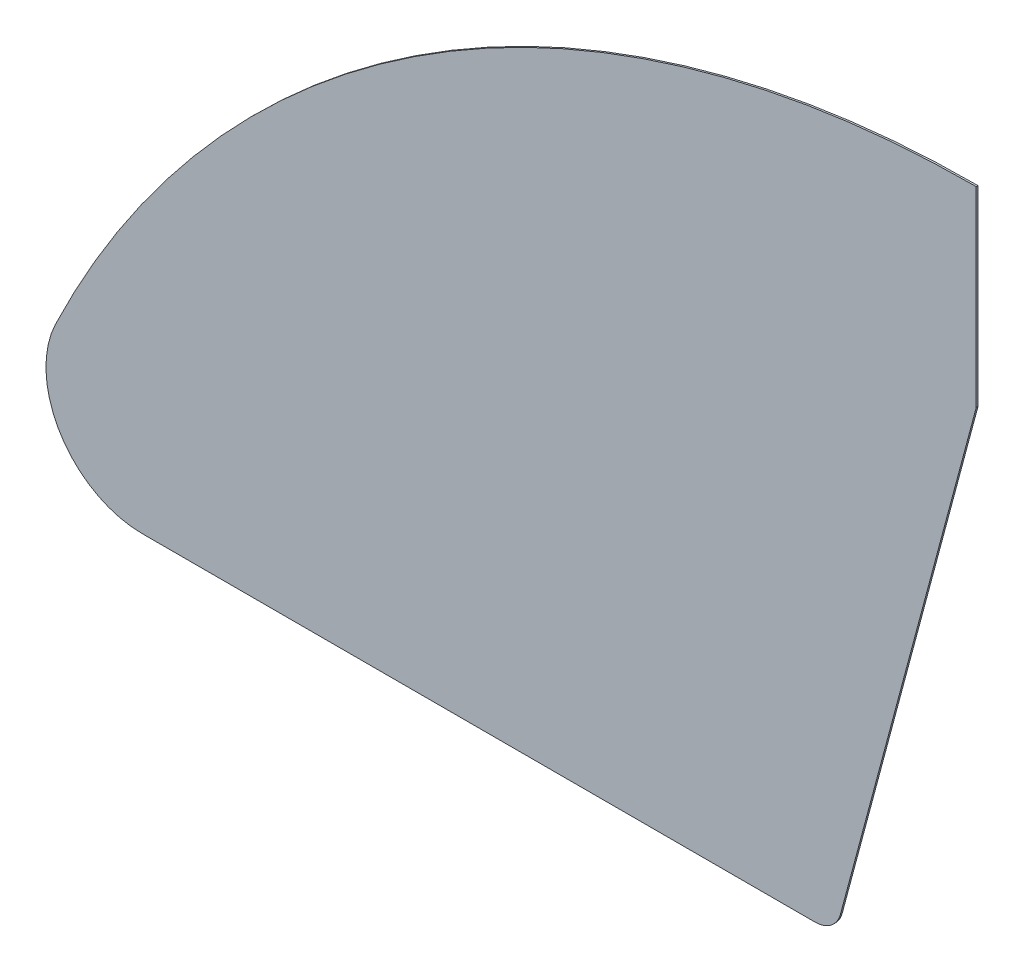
SolidWorks part; units mm, degrees
ref_plane "Plan1" through (0, 0, 0) normal (0, 0, 1) x (1, 0, 0)
ref_plane "Plan2" through (0, 0, 0) normal (0, 1, 0) x (1, 0, 0)
ref_plane "Plan3" through (0, 0, 0) normal (1, 0, 0) x (0, 0, -1)
sketch "Esquisse1" plane through (0, 0, 0) normal (0, 0, 1) x (1, 0, 0)
  line L3 (1, 1.0039) -> (1, -20.8581)
  line L4 (1, -20.8581) -> (-14.5181, -78.7725)
  line L5 (-17.4159, -80.9961) -> (-94.3072, -80.9961)
  arc A3 (-14.5181, -78.7725) -> (-17.4159, -80.9961) centre (-17.4159, -77.9961) cw
  arc A4 (-104.2281, -65.2446) -> (-94.3072, -80.9961) centre (-94.3072, -69.9961) ccw
  arc A5 (1, 1.0039) -> (-104.2281, -65.2446) centre (0.9556, -115.6211) ccw
extrude "Extrusion1" add sketch "Esquisse1" along normal blind 0.2
sketch "Esquisse2" plane through (0, 0, 0) normal (0, 0, 1) x (1, 0, 0)
  line L0 (0, 0) -> (-53.6047, 0) construction
